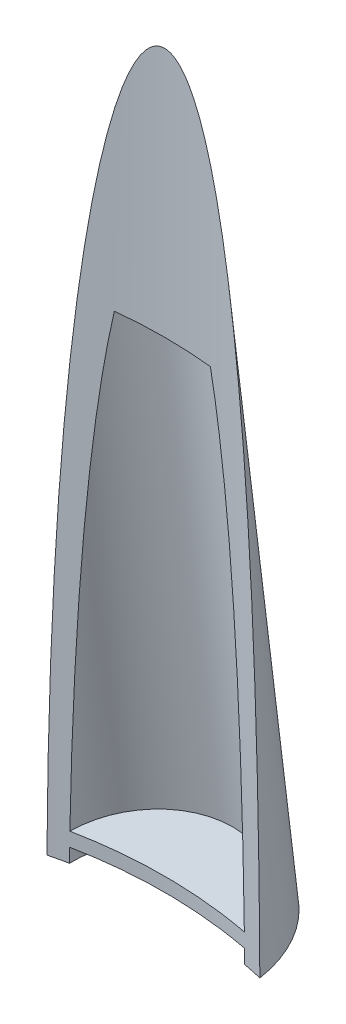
SolidWorks part; units mm, degrees
ref_plane "Front Plane" through (0, 0, 0) normal (0, 0, 1) x (1, 0, 0)
ref_plane "Top Plane" through (0, 0, 0) normal (0, 1, 0) x (1, 0, 0)
ref_plane "Right Plane" through (0, 0, 0) normal (1, 0, 0) x (0, 0, -1)
sketch "Sketch7" plane through (0, 0, 0) normal (0, 0, 1) x (1, 0, 0)
  circle A0 centre (0, 0) radius 14.605
  dimension "D1" = 29.21
extrude "Boss-Extrude4" add sketch "Sketch7" along normal blind 101.6
sketch "Sketch8" plane through (0, 0, 101.6) normal (0, 0, 1) x (1, 0, 0)
  circle A0 centre (0, 0) radius 12.065
  dimension "D1" = 24.13
extrude "Cut-Extrude1" cut sketch "Sketch8" against normal blind 63.5 from offset 3.81
sketch "Sketch12" plane through (0, 0, 101.6) normal (0, 0, 1) x (1, 0, 0)
  circle A0 centre (0, 0) radius 12.065
  dimension "D1" = 24.13
extrude "Cut-Extrude3" cut sketch "Sketch12" against normal blind 1.905
move or copy body "Body-Move/Copy2" bodies to move or copy 114 copy no rotation origin (0, 0, 25.4) rotation axis (1, 0, 0) rotation angle 97
sketch "Sketch10" plane through (0, 0, 0) normal (0, 1, 0) x (1, 0, 0)
  circle A0 centre (0, 0) radius 4.2863
extrude "Boss-Extrude7" add sketch "Sketch10" along normal blind 7.62 separate body
move or copy body "Body-Move/Copy3" bodies to move or copy 110 copy no translate (0, -27.94, 83.82)
sketch "Sketch11" plane through (0, -27.94, 0) normal (0, -1, 0) x (1, 0, 0)
  circle A0 centre (0, 83.82) radius 69.85
  dimension "D1" = 139.7
extrude "Cut-Extrude2" cut sketch "Sketch11" against normal through all both and the other way through all contours A0
